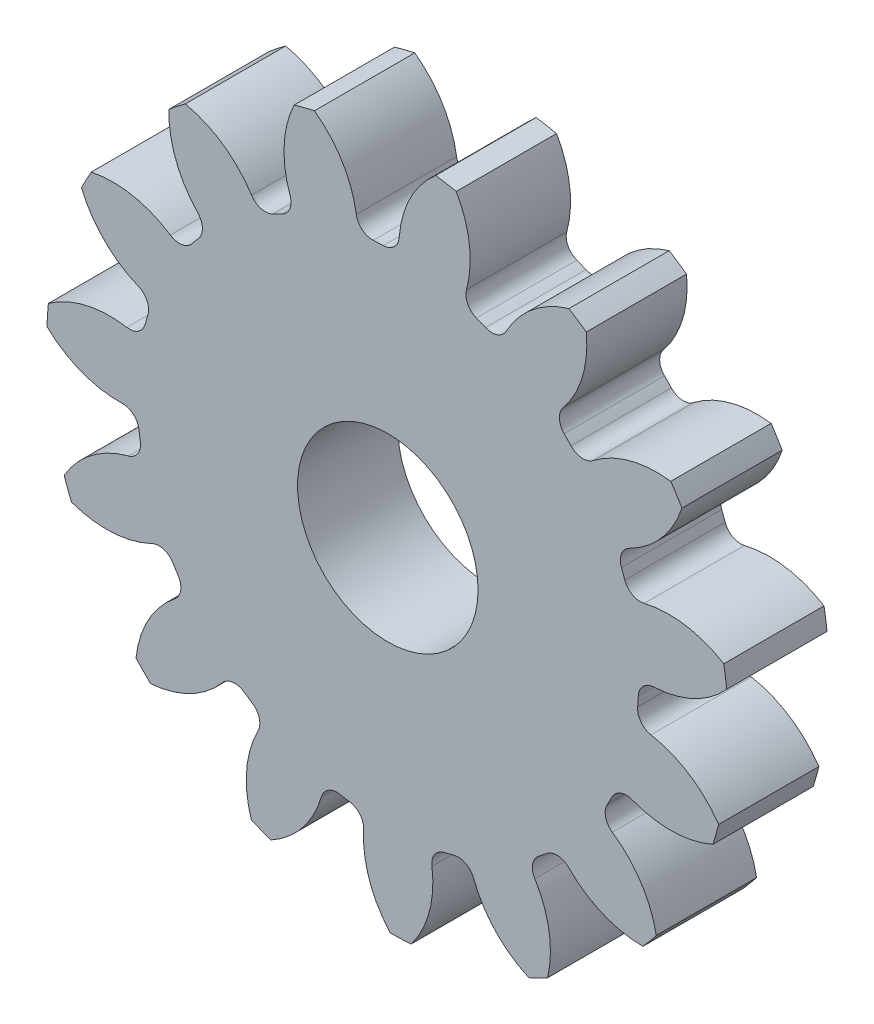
SolidWorks part; units mm, degrees
ref_plane "Front" through (0, 0, 0) normal (0, 0, 1) x (1, 0, 0)
ref_plane "Top" through (0, 0, 0) normal (0, 1, 0) x (1, 0, 0)
ref_plane "Right" through (0, 0, 0) normal (1, 0, 0) x (0, 0, -1)
sketch "Sketch3" plane through (0, 0, 0) normal (0, 0, 1) x (1, 0, 0)
  circle A0 centre (0, 0) radius 431.8
  dimension "od" = 863.6
extrude "gearBody" add sketch "Sketch3" along normal blind 127
sketch "Sketch2" plane through (0, 0, 0) normal (0, 0, 1) x (1, 0, 0)
  line L0 (0, 0) -> (330.77, 137.0094) construction
  line L1 (421.1074, -108.4322) -> (0, 0) construction
  line L2 (0, 0) -> (36.3143, 0) construction
  line L3 (380.7299, 14.3428) -> (375.4245, -64.9419) construction
  line L5 (378.0772, -25.2996) -> (0, 0) construction
  line L7 (0, 0) -> (358.0229, 0) construction
  arc A0 (357.9469, 7.3772) -> (353.7726, -55.0029) centre (0, 0) ccw construction
  arc A1 (429.094, 48.2655) -> (418.8376, -105.006) centre (0, 0) ccw construction
  arc A2 (380.7299, 14.3428) -> (375.4245, -64.9419) centre (0, 0) ccw construction
  arc A3 (316.3147, -27.4093) -> (317.1464, -14.9797) centre (0, 0) ccw
  arc A4 (421.1074, -108.4322) -> (333.2206, -49.5374) centre (309.5664, -179.8584) ccw
  arc A5 (421.1074, -108.4322) -> (431.8, 51.3587) centre (0, 0) ccw
  arc A6 (431.8, 51.3587) -> (336.8499, 4.6987) centre (330.77, 137.0094) cw
  arc A7 (317.1464, -14.9797) -> (336.8499, 4.6987) centre (337.799, -15.9551) cw
  arc A8 (333.2206, -49.5374) -> (316.3147, -27.4093) centre (336.9131, -29.1942) cw
  point P6 (431.8, 51.3587)
  point P22 (421.1074, -108.4322)
  dimension "baseDia" = 716.0458
  dimension "od" = 863.6
  dimension "pd" = 762
  dimension "rd" = 635
  dimension "rFillet" = 20.6756
  dimension "pointX" = 431.8
  dimension "pointY" = 51.3587
  dimension "CTT" = 79.2847
  dimension "flankCenterAngle" = 22.5
extrude "toothCut" cut sketch "Sketch2" along normal through all
pattern_circular "CirPattern1" count 15 over 360 about axis through (0, 0, 0) along (0, 0, 1) of "toothCut"
sketch "hub1Dia" plane through (0, 0, 0) normal (0, 0, -1) x (-1, 0, 0)
  circle A0 centre (0, 0) radius 12.7
  dimension "hub1Dia" = 25.4
sketch "hub2Dia" plane through (0, 0, 127) normal (0, 0, 1) x (1, 0, 0)
  circle A0 centre (0, 0) radius 12.7
  dimension "hub2dia" = 25.4
sketch "boreDia" plane through (0, 0, 0) normal (0, 0, 1) x (1, 0, 0)
  circle A0 centre (0, 0) radius 114.3
  dimension "boreDia" = 228.6
extrude "bore" cut sketch "boreDia" against normal mid plane 25400
